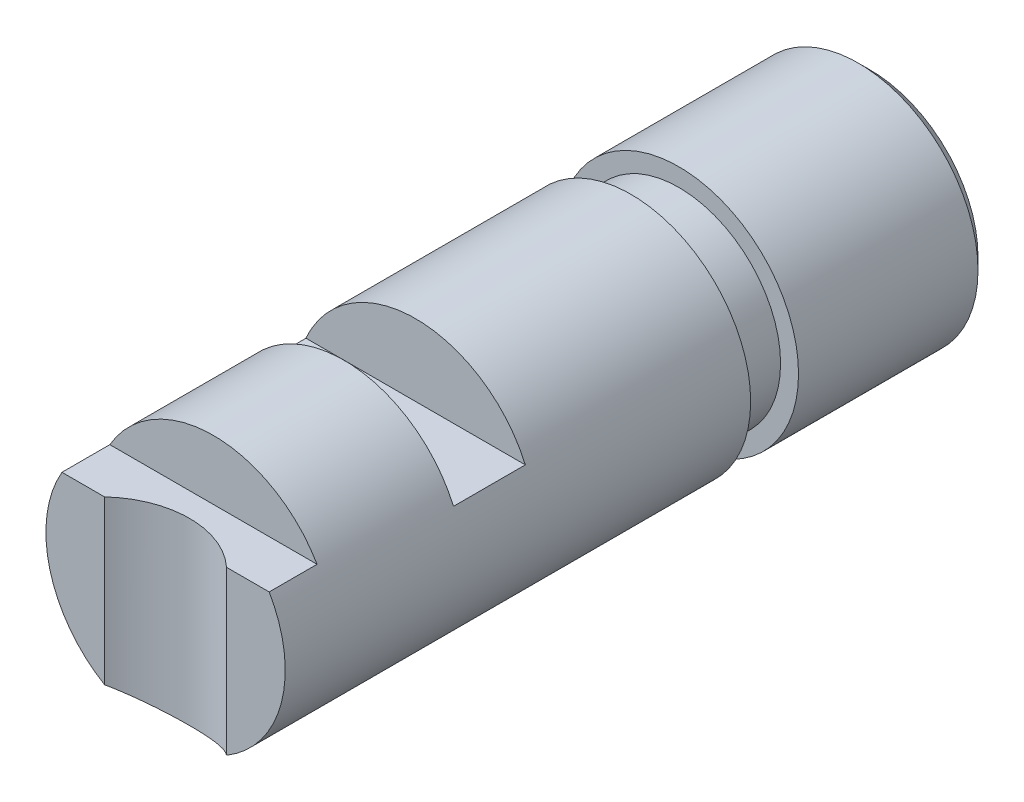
SolidWorks part; units mm, degrees
ref_plane "Plan de face" through (0, 0, 0) normal (0, 0, 1) x (1, 0, 0)
ref_plane "Plan de dessus" through (0, 0, 0) normal (0, 1, 0) x (1, 0, 0)
ref_plane "Plan de droite" through (0, 0, 0) normal (1, 0, 0) x (0, 0, -1)
sketch "Esquisse1" plane through (0, 0, 0) normal (0, 0, 1) x (1, 0, 0)
  circle A0 centre (0, 0) radius 5
  dimension "D1" = 10
extrude "Extrusion1" add sketch "Esquisse1" along normal blind 29.45
ref_plane "Plan3" through (0, 0, 8) normal (0, 0, 1) x (1, 0, 0)
sketch "Esquisse6" plane through (0, 0, 8) normal (0, 0, 1) x (1, 0, 0)
  circle A0 centre (0, 0) radius 4.25
  dimension "D1" = 8.5
extrude "Enlèv. mat.-Extru.4" cut sketch "Esquisse6" along normal blind 2 flip side to cut
chamfer "Chanfrein1" distance 0.5 angle 45 1 edges at (5, 0, 0)
ref_plane "Plan4" through (0, 0, 19) normal (0, 0, -1) x (-1, 0, 0)
sketch "Esquisse8" plane through (0, 0, 19) normal (0, 0, -1) x (-1, 0, 0)
  line L1 (-5.233, 5.5358) -> (5.2095, 5.5358)
  line L2 (-5.233, 5.5358) -> (-5.233, 2)
  line L3 (-5.233, 2) -> (5.2095, 2)
  line L4 (5.2095, 5.5358) -> (5.2095, 2)
  dimension "D1" = 2
extrude "Enlèv. mat.-Extru.5" cut sketch "Esquisse8" against normal blind 3
ref_plane "Plan5" through (0, 5, 0) normal (0, 1, 0) x (-1, 0, 0)
sketch "Esquisse9" plane through (0, 5, 0) normal (0, 1, 0) x (-1, 0, 0)
  line L0 (5, 29.45) -> (-5, 29.45) construction
  line L1 (5, 29.45) -> (-5, 29.45)
  line L2 (-5, 29.45) -> (-5, 27.45)
  line L3 (-5, 29.45) -> (-5, 10) construction
  line L4 (-5, 27.45) -> (5, 27.45)
  line L5 (5, 10) -> (5, 29.45) construction
  line L6 (5, 27.45) -> (5, 29.45)
  dimension "D1" = 2
extrude "Enlèv. mat.-Extru.6" cut sketch "Esquisse9" against normal blind 2.5
sketch "Esquisse10" plane through (0, 2.5, 0) normal (0, 1, 0) x (-1, 0, 0)
  line L0 (4.3301, 27.45) -> (-4.3301, 27.45) construction
  circle A0 centre (0, 32.2) radius 3.75
  dimension "D1" = 7.5
  dimension "D2" = 4.75
extrude "Enlèv. mat.-Extru.7" cut sketch "Esquisse10" against normal through all
